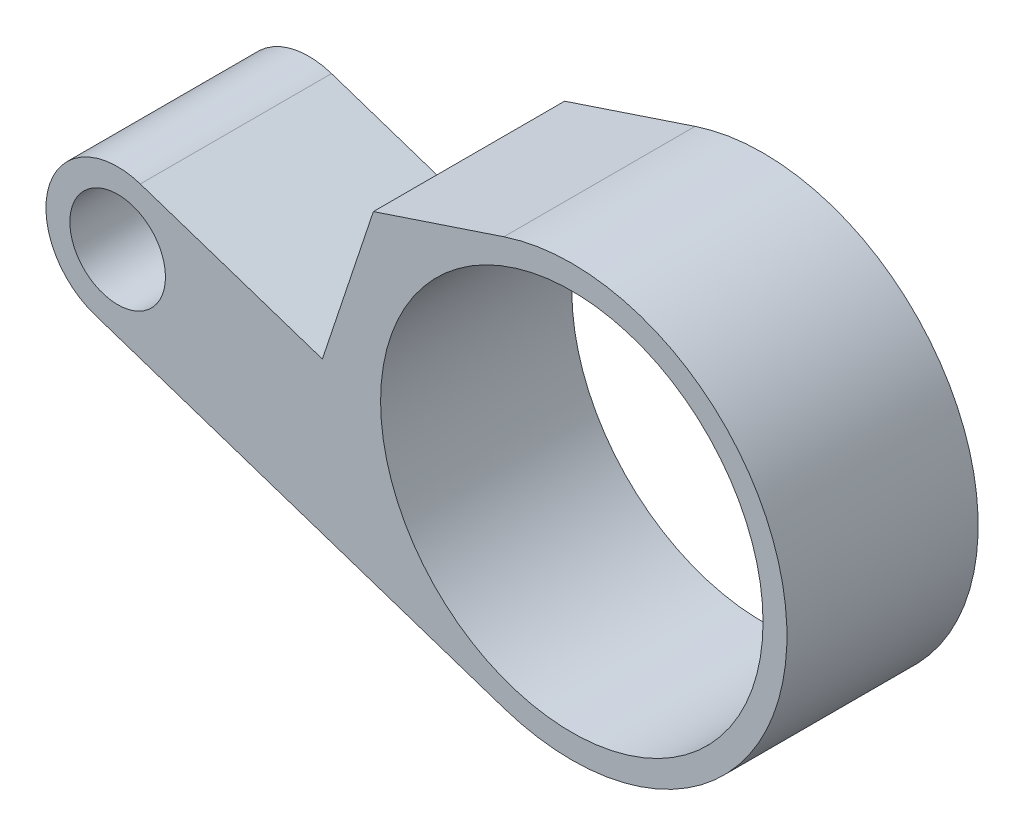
SolidWorks part; units mm, degrees
ref_plane "Front Plane" through (0, 0, 0) normal (0, 0, 1) x (1, 0, 0)
ref_plane "Top Plane" through (0, 0, 0) normal (0, 1, 0) x (1, 0, 0)
ref_plane "Right Plane" through (0, 0, 0) normal (1, 0, 0) x (0, 0, -1)
sketch "Sketch1" plane through (0, 0, 0) normal (0, 0, 1) x (1, 0, 0)
  line L0 (0, 0) -> (-60.325, 0) construction
  line L1 (-26.3588, 21.3433) -> (-9.0237, 27.1128)
  line L2 (-63.3329, -9.0376) -> (-9.0237, -27.1128)
  line L3 (0, 0) -> (-69.85, 0) construction
  line L4 (-26.3588, 21.3433) -> (-33.1332, 0.9887)
  line L5 (-33.1332, 0.9887) -> (-57.3171, 9.0376)
  circle A0 centre (0, 0) radius 25.4
  arc A1 (-9.0237, -27.1128) -> (-9.0237, 27.1128) centre (0, 0) ccw
  arc A2 (-57.3171, 9.0376) -> (-63.3329, -9.0376) centre (-60.325, 0) ccw
  circle A3 centre (-60.325, 0) radius 6.35
  dimension "D1" = 50.8
  dimension "D2" = 28.575
  dimension "D3" = 12.7
  dimension "D4" = 69.85
  dimension "D5" = 60.325
  dimension "D6" = 31.75
extrude "Boss-Extrude1" add sketch "Sketch1" along normal blind 25.4
